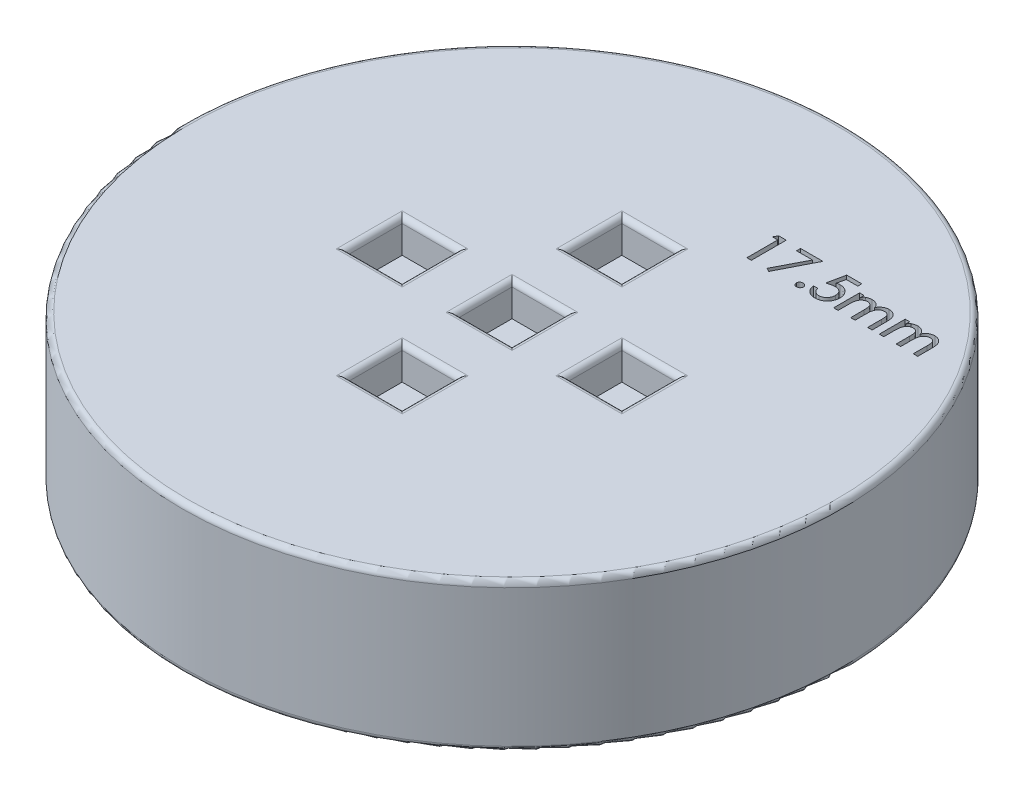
SolidWorks part; units mm, degrees
ref_plane "Front Plane" through (0, 0, 0) normal (0, 0, 1) x (1, 0, 0)
ref_plane "Top Plane" through (0, 0, 0) normal (0, 1, 0) x (1, 0, 0)
ref_plane "Right Plane" through (0, 0, 0) normal (1, 0, 0) x (0, 0, -1)
sketch "Sketch1" plane through (0, 0, 0) normal (0, 1, 0) x (1, 0, 0)
  circle A0 centre (0, 0) radius 30
extrude "Boss-Extrude1" add sketch "Sketch1" along normal blind 13.5
sketch "Sketch2" plane through (0, 13.5, 0) normal (0, 1, 0) x (1, 0, 0)
  line L0 (0, 0) -> (0, -10) construction
  line L1 (0, 0) -> (10, 0) construction
  line L2 (0, 0) -> (-10, 0) construction
  line L3 (0, 0) -> (0, 10) construction
  line L5 (-2.5, -7.5) -> (2.5, -7.5)
  line L6 (-2.5, -7.5) -> (-2.5, -12.5)
  line L7 (-2.5, -12.5) -> (2.5, -12.5)
  line L8 (2.5, -7.5) -> (2.5, -12.5)
  line L9 (-2.5, -7.5) -> (2.5, -12.5) construction
  line L10 (-2.5, -12.5) -> (2.5, -7.5) construction
  line L11 (-7.5, -2.5) -> (-12.5, -2.5)
  line L12 (-7.5, -2.5) -> (-7.5, 2.5)
  line L13 (-7.5, 2.5) -> (-12.5, 2.5)
  line L14 (-12.5, -2.5) -> (-12.5, 2.5)
  line L15 (-7.5, -2.5) -> (-12.5, 2.5) construction
  line L16 (-7.5, 2.5) -> (-12.5, -2.5) construction
  line L17 (2.5, -2.5) -> (-2.5, -2.5)
  line L18 (2.5, -2.5) -> (2.5, 2.5)
  line L19 (2.5, 2.5) -> (-2.5, 2.5)
  line L20 (-2.5, -2.5) -> (-2.5, 2.5)
  line L21 (2.5, -2.5) -> (-2.5, 2.5) construction
  line L22 (2.5, 2.5) -> (-2.5, -2.5) construction
  line L23 (-2.5, 12.5) -> (2.5, 12.5)
  line L24 (-2.5, 12.5) -> (-2.5, 7.5)
  line L25 (-2.5, 7.5) -> (2.5, 7.5)
  line L26 (2.5, 12.5) -> (2.5, 7.5)
  line L27 (-2.5, 12.5) -> (2.5, 7.5) construction
  line L28 (-2.5, 7.5) -> (2.5, 12.5) construction
  line L29 (12.5, -2.5) -> (7.5, -2.5)
  line L30 (12.5, -2.5) -> (12.5, 2.5)
  line L31 (12.5, 2.5) -> (7.5, 2.5)
  line L32 (7.5, -2.5) -> (7.5, 2.5)
  line L33 (12.5, -2.5) -> (7.5, 2.5) construction
  line L34 (12.5, 2.5) -> (7.5, -2.5) construction
  dimension "D1" = 5
  dimension "D2" = 10
  dimension "D3" = 5
  dimension "D4" = 5
  dimension "D5" = 5
  dimension "D6" = 5
  dimension "D7" = 5
  dimension "D8" = 5
extrude "Cut-Extrude1" cut sketch "Sketch2" against normal blind 3
fillet "Fillet1" radius 0.5 6 edges at (2.5, 13.5, 0) (0, 13.5, 2.5) (-12.5, 13.5, 0) (-10, 13.5, 2.5) (-7.5, 13.5, 0) (-10, 13.5, -2.5)
sketch "Sketch3" plane through (0, 13.5, 0) normal (0, 1, 0) x (1, 0, 0)
sketch "Sketch4" plane through (0, 0, 0) normal (0, -1, 0) x (-1, 0, 0)
  line L0 (0, 0) -> (-10, 0) construction
  line L1 (0, 0) -> (0, -10) construction
  line L2 (0, 0) -> (0, 10) construction
  line L3 (0, 0) -> (10, 0) construction
  line L5 (-2.5, 2.5) -> (2.5, 2.5)
  line L6 (-2.5, 2.5) -> (-2.5, -2.5)
  line L7 (-2.5, -2.5) -> (2.5, -2.5)
  line L8 (2.5, 2.5) -> (2.5, -2.5)
  line L9 (-2.5, 2.5) -> (2.5, -2.5) construction
  line L10 (-2.5, -2.5) -> (2.5, 2.5) construction
  line L11 (-2.5, -7.5) -> (2.5, -7.5)
  line L12 (-2.5, -7.5) -> (-2.5, -12.5)
  line L13 (-2.5, -12.5) -> (2.5, -12.5)
  line L14 (2.5, -7.5) -> (2.5, -12.5)
  line L15 (-2.5, -7.5) -> (2.5, -12.5) construction
  line L16 (-2.5, -12.5) -> (2.5, -7.5) construction
  line L17 (7.5, 2.5) -> (12.5, 2.5)
  line L18 (7.5, 2.5) -> (7.5, -2.5)
  line L19 (7.5, -2.5) -> (12.5, -2.5)
  line L20 (12.5, 2.5) -> (12.5, -2.5)
  line L21 (7.5, 2.5) -> (12.5, -2.5) construction
  line L22 (7.5, -2.5) -> (12.5, 2.5) construction
  line L23 (-12.5, 2.5) -> (-7.5, 2.5)
  line L24 (-12.5, 2.5) -> (-12.5, -2.5)
  line L25 (-12.5, -2.5) -> (-7.5, -2.5)
  line L26 (-7.5, 2.5) -> (-7.5, -2.5)
  line L27 (-12.5, 2.5) -> (-7.5, -2.5) construction
  line L28 (-12.5, -2.5) -> (-7.5, 2.5) construction
  line L29 (2.5, 7.5) -> (-2.5, 7.5)
  line L30 (2.5, 7.5) -> (2.5, 12.5)
  line L31 (2.5, 12.5) -> (-2.5, 12.5)
  line L32 (-2.5, 7.5) -> (-2.5, 12.5)
  line L33 (2.5, 7.5) -> (-2.5, 12.5) construction
  line L34 (2.5, 12.5) -> (-2.5, 7.5) construction
  dimension "D1" = 5
  dimension "D2" = 5
  dimension "D3" = 5
  dimension "D4" = 5
  dimension "D5" = 5
  dimension "D6" = 5
extrude "Cut-Extrude2" cut sketch "Sketch4" against normal blind 3
fillet "Fillet2" radius 0.5 21 edges at (0, 0, 30) (2.5, 0, 0) (0, 0, 2.5) (-2.5, 0, 0) (0, 0, -2.5) (2.5, 0, 10) (0, 0, 12.5) (-2.5, 0, 10) (0, 0, 7.5) (-7.5, 0, 0) (-10, 0, 2.5) (-12.5, 0, 0) (-10, 0, -2.5) (12.5, 0, 0) (10, 0, 2.5) (7.5, 0, 0) (10, 0, -2.5) (-2.5, 0, -10) (0, 0, -12.5) (2.5, 0, -10) (0, 0, -7.5)
fillet "Fillet3" radius 0.5 15 edges at (0, 13.5, 30) (0, 13.5, 7.5) (-2.5, 13.5, 10) (0, 13.5, 12.5) (2.5, 13.5, 10) (-2.5, 13.5, 0.25) (0.25, 13.5, -2.5) (0, 13.5, -12.5) (-2.5, 13.5, -10) (0, 13.5, -7.5) (2.5, 13.5, -10) (10, 13.5, 2.5) (12.5, 13.5, 0) (10, 13.5, -2.5) (7.5, 13.5, 0)
sketch "Sketch5" plane through (0, 13.5, 0) normal (0, 1, 0) x (1, 0, 0)
  text T0 "<b>17.5mm</b>"
extrude "Cut-Extrude3" cut sketch "Sketch5" against normal blind 2
